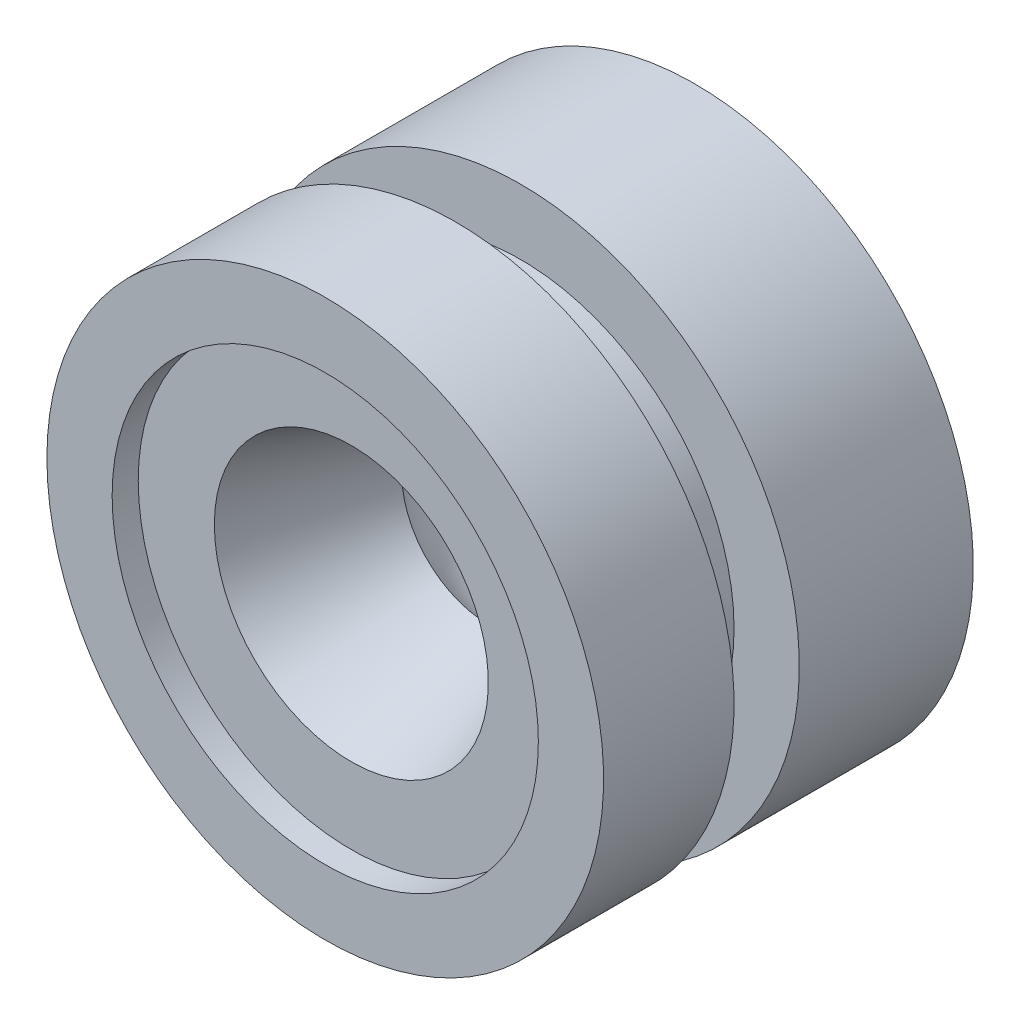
SolidWorks part; units mm, degrees
ref_plane "Plan de face" through (0, 0, 0) normal (0, 0, 1) x (1, 0, 0)
ref_plane "Plan de dessus" through (0, 0, 0) normal (0, 1, 0) x (1, 0, 0)
ref_plane "Plan de droite" through (0, 0, 0) normal (1, 0, 0) x (0, 0, -1)
sketch "Esquisse1" plane through (0, 0, 0) normal (0, 1, 0) x (1, 0, 0)
  line L0 (0, 42.8402) -> (-3.8, 42.8402)
  line L1 (-3.8, 42.8402) -> (-3.8, 39.3402)
  line L2 (-3.8, 39.3402) -> (-5.9, 39.3402)
  line L3 (-5.9, 39.3402) -> (-5.9, 42.8402)
  line L4 (-5.9, 42.8402) -> (-6.4, 42.8402)
  line L5 (-6.4, 42.8402) -> (-6.4, 38.8402)
  line L6 (-6.4, 38.8402) -> (-4.9, 38.8402)
  line L7 (-4.9, 38.8402) -> (-4.9, 37.3402)
  line L8 (-4.9, 37.3402) -> (-6.4, 37.3402)
  line L9 (-6.4, 37.3402) -> (-6.4, 34.3402)
  line L10 (-6.4, 34.3402) -> (-4.9, 34.3402)
  line L11 (-4.9, 34.3402) -> (-4.9, 34.9402)
  line L12 (-4.9, 34.9402) -> (-3.15, 34.9402)
  line L13 (-3.15, 34.9402) -> (-2, 38.0998)
  line L14 (0, 42.8402) -> (0, 42.0998)
  arc A0 (0, 42.0998) -> (-2, 38.0998) centre (0, 39.5998) ccw
  dimension "D14" = 2
  dimension "D15" = 2.5
  dimension "D1" = 6.4
  dimension "D2" = 3.8
  dimension "D3" = 0.5
  dimension "D4" = 4
  dimension "D5" = 1.5
  dimension "D6" = 1.5
  dimension "D7" = 1.5
  dimension "D8" = 3.5
  dimension "D9" = 8.5
  dimension "D10" = 1.5
  dimension "D11" = 0.6
  dimension "D12" = 1.75
  dimension "D13" = 110
revolve "Révolution1" add sketch "Esquisse1" angle 360 about L14
